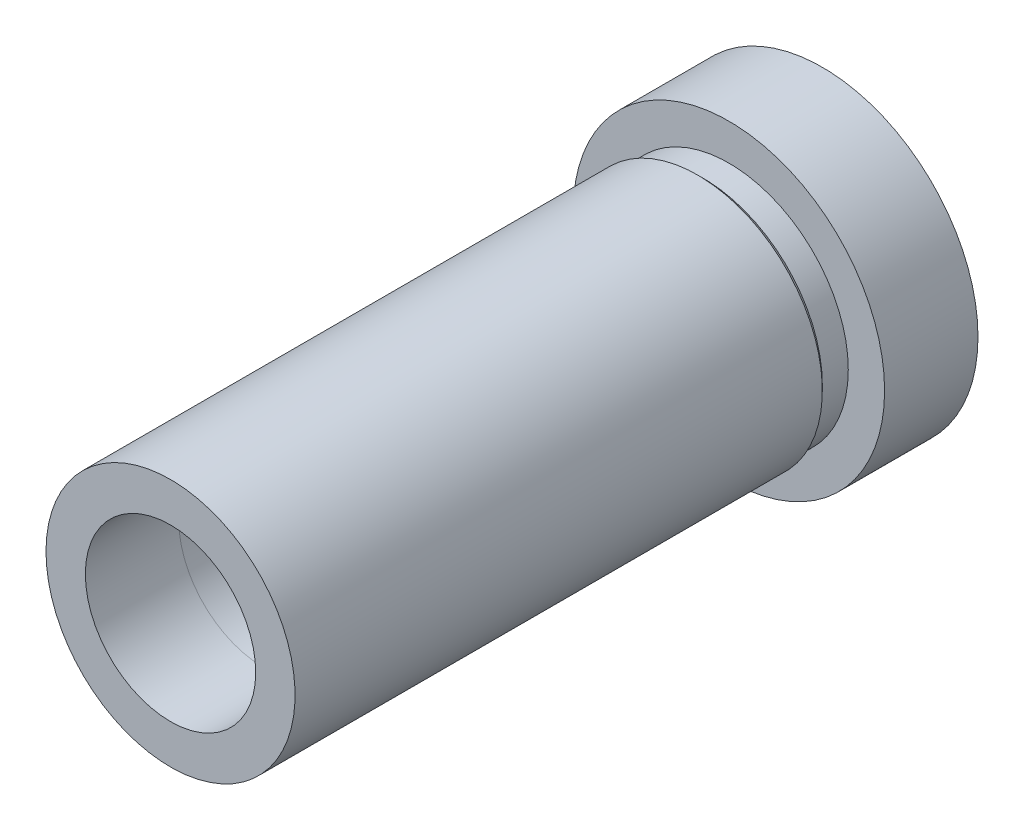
SolidWorks part; units mm, degrees
ref_plane "Front" through (0, 0, 0) normal (0, 0, 1) x (1, 0, 0)
ref_plane "Top" through (0, 0, 0) normal (0, 1, 0) x (1, 0, 0)
ref_plane "Right" through (0, 0, 0) normal (1, 0, 0) x (0, 0, -1)
sketch "Logo3_Revol_Axis" plane through (0, 0, 0) normal (0, 1, 0) x (1, 0, 0)
  line L0 (0, -30.1653) -> (0, 30.1653) construction
sketch "Logo3_bib1" plane through (0, 0, 0) normal (0, -1, 0) x (-1, 0, 0)
  line L1 (4.3434, -28.4734) -> (6.35, -28.4734)
  line L2 (6.35, -28.4734) -> (6.35, -1.5875)
  line L4 (6.0854, 0) -> (6.0854, -1.3229)
  line L5 (6.0854, 0) -> (7.9375, 0)
  line L6 (7.9375, 0) -> (7.9375, 4.7625)
  line L7 (4.5034, 4.7625) -> (4.3434, -23.7109)
  line L8 (4.3434, -23.7109) -> (4.3434, -28.4734)
  line L9 (7.9375, 4.7625) -> (4.5034, 4.7625)
  line L10 (0, 19.4323) -> (0, -23.9633) construction
  line L11 (6.35, -1.5875) -> (6.0854, -1.3229)
  point P11 (4.5034, 4.7625)
revolve "Revolve1" add sketch "Logo3_bib1" angle 360 about L10
equation "\"rainure@Logo3_bib1\" = (\"logo3_l1@Logo3_bib1\" -\"logo3_l3@Logo3_bib1\")/3"
equation "\"prof_rainure@Logo3_bib1\" = (\"logo3_d4@Logo3_bib1\"-\"logo3_d3@Logo3_bib1\")/12"
